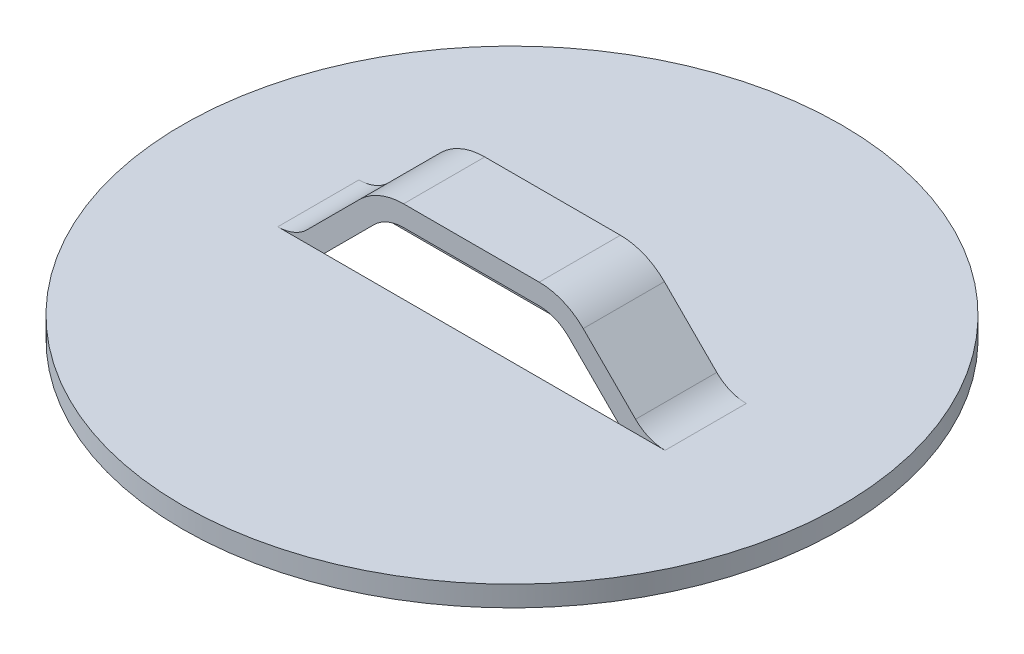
SolidWorks part; units mm, degrees
other "Boss-Extrude1"
ref_plane "Front Plane" through (0, 0, 0) normal (0, 0, 1) x (1, 0, 0)
ref_plane "Top Plane" through (0, 0, 0) normal (0, 1, 0) x (1, 0, 0)
ref_plane "Right Plane" through (0, 0, 0) normal (1, 0, 0) x (0, 0, -1)
imported_body "Imported1"
sketch "Sketch1" plane through (0, -0.9906, 0) normal (0, -1, 0) x (1, 0, 0)
  line L0 (0, 0) -> (0, -3.9116) construction
  line L1 (3.267, -3.9116) -> (-3.267, -3.9116) construction
  line L2 (15.875, -3.9116) -> (15.875, 0) construction
  line L3 (-9.3275, -3.9116) -> (9.3275, -3.9116)
  line L4 (-9.3275, -3.9116) -> (-9.3275, 0)
  line L5 (-9.3275, 0) -> (9.3275, 0)
  line L6 (9.3275, -3.9116) -> (9.3275, 0)
  line L7 (-9.3275, -3.9116) -> (9.3275, 0) construction
  line L8 (-9.3275, 0) -> (9.3275, -3.9116) construction
  circle A0 centre (0, -1.9558) radius 15.875
  point P5 (0, -1.9558)
extrude "Boss-Extrude1" add sketch "Sketch1" against normal up to vertex
other "DeleteFace1"
